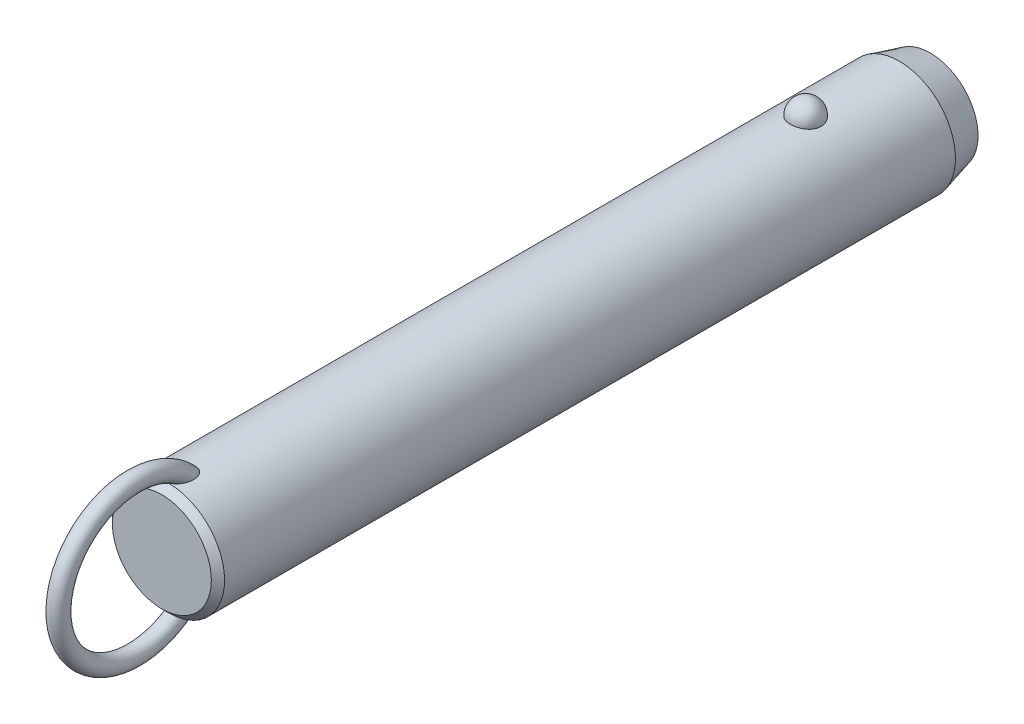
SolidWorks part; units mm, degrees
ref_plane "Front Plane" through (0, 0, 0) normal (0, 0, 1) x (1, 0, 0)
ref_plane "Top Plane" through (0, 0, 0) normal (0, 1, 0) x (1, 0, 0)
ref_plane "Right Plane" through (0, 0, 0) normal (1, 0, 0) x (0, 0, -1)
sketch "Sketch2" plane through (0, 0, 0) normal (0, 0, 1) x (1, 0, 0)
  circle A0 centre (0, 0) radius 12.7
  point P3 (0, 12.7)
  dimension "D1" = 25.4
extrude "Boss-Extrude1" add sketch "Sketch2" along normal blind 129.5
sketch "Sketch3" plane through (0, 0, 0) normal (0, 0, -1) x (-1, 0, 0)
  circle A0 centre (0, 0) radius 12.7
  dimension "D1" = 25.4
extrude "Boss-Extrude2" add sketch "Sketch3" along normal blind 31.7
chamfer "Chamfer1" distance 7 angle 15 1 edges at (-12.7, 0, -31.7)
sketch "Sketch12" plane through (0, 0, 0) normal (1, 0, 0) x (0, 0, -1)
  line L0 (-129.5, 12.7) -> (-129.5, -12.7) construction
  point P0 (-129.5, 0)
sketch "Sketch13" plane through (0, 0, 0) normal (1, 0, 0) x (0, 0, -1)
  circle A0 centre (-148.55, 0) radius 19.05
  point P2 (-129.5, 0)
  dimension "D1" = 38.1
sketch "Sketch14" plane through (0, 0, 0) normal (0, 1, 0) x (1, 0, 0)
  circle A0 centre (0, -131.5) radius 2
  point P2 (0, -129.5)
  dimension "D1" = 4
sweep "Sweep1" add profiles "Sketch14" path "Sketch13"
sketch "Sketch15" plane through (0, 0, 129.5) normal (0, 0, 1) x (1, 0, 0)
  circle A0 centre (0, 0) radius 12.7
  dimension "D1" = 25.4
extrude "Boss-Extrude3" add sketch "Sketch15" along normal blind 12.7
chamfer "Chamfer2" distance 1.5 angle 45 1 edges at (12.7, 0, 142.2)
sketch "Sketch18" plane through (0, 0, 0) normal (1, 0, 0) x (0, 0, -1)
  line L0 (24.7, 12.7) -> (-134.351, 12.7) construction
  line L1 (3.5, 16.2) -> (3.5, 9.2)
  line L2 (-134.351, -12.7) -> (24.7, -12.7) construction
  arc A0 (3.5, 16.2) -> (3.5, 9.2) centre (3.5, 12.7) ccw
  point P4 (0, 12.7)
  dimension "D1" = 28.9
revolve "Revolve1" add sketch "Sketch18" angle 360 about L1
